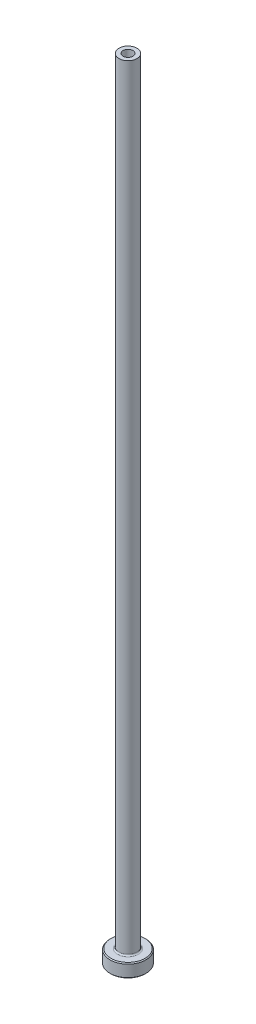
SolidWorks part; units mm, degrees
ref_plane "Front Plane" through (0, 0, 0) normal (0, 0, 1) x (1, 0, 0)
ref_plane "Top Plane" through (0, 0, 0) normal (0, 1, 0) x (1, 0, 0)
ref_plane "Right Plane" through (0, 0, 0) normal (1, 0, 0) x (0, 0, -1)
sketch "Sketch1" plane through (0, 0, 0) normal (0, 0, 1) x (1, 0, 0)
  line L0 (-1.1, 175) -> (-2, 175)
  line L1 (-2, 175) -> (-2, 3)
  line L2 (-2, 3) -> (-4, 3)
  line L3 (-4, 3) -> (-4, 0)
  line L4 (4.4, 0) -> (-4.4, 0) construction
  line L5 (-4, 0) -> (-1.35, 0)
  line L6 (-1.1, 140) -> (-1.1, 175)
  line L7 (0, 92.1877) -> (0, -15.5353) construction
  line L8 (0, -4.4) -> (0, 4.4) construction
  line L9 (-1.1, 140) -> (-1.35, 128)
  line L10 (-1.35, 128) -> (-1.35, 0)
  dimension "D1" = 0.25
  dimension "ID" = 2.2
  dimension "OD" = 4
  dimension "L" = 175
  dimension "H" = 8
  dimension "T" = 3
  dimension "N" = 35
  dimension "D2" = 12
revolve "Revolve1" add sketch "Sketch1" angle 360 about L7
fillet "Fillet1" radius 0.3 1 edges at (0, 3, 2)
chamfer "Chamfer1" distance 0.2 angle 45 2 edges at (0, 3, 4) (0, 0, 4)
chamfer "Chamfer3" distance 0.5 angle 45 1 edges at (0, 0, 1.35)
